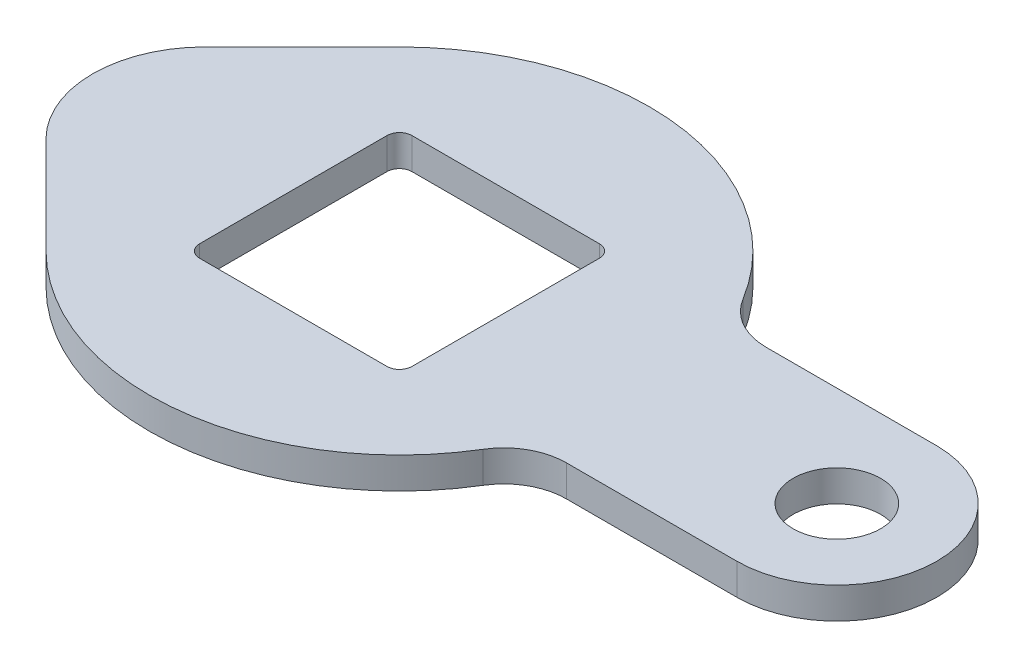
SolidWorks part; units mm, degrees
ref_plane "前基準面" through (0, 0, 0) normal (0, 0, 1) x (1, 0, 0)
ref_plane "上基準面" through (0, 0, 0) normal (0, 1, 0) x (1, 0, 0)
ref_plane "右基準面" through (0, 0, 0) normal (1, 0, 0) x (0, 0, -1)
sketch "草圖1" plane through (0, 0, 0) normal (0, 1, 0) x (1, 0, 0)
  line L0 (-52.9239, 0) -> (52.9239, 0) construction
  line L1 (0, 24.8748) -> (0, -24.8748) construction
  line L2 (-14.1421, 14.1421) -> (-21.9203, 6.364)
  line L3 (-21.9203, -6.364) -> (-14.1421, -14.1421)
  line L4 (-7.5, 8.5) -> (7.5, 8.5)
  line L5 (-8.5, 7.5) -> (-8.5, -7.5)
  line L6 (-7.5, -8.5) -> (7.5, -8.5)
  line L7 (8.5, 7.5) -> (8.5, -7.5)
  line L8 (35, 8) -> (21.3542, 8)
  line L9 (35, -8) -> (21.3542, -8)
  arc A0 (-7.5, 8.5) -> (-8.5, 7.5) centre (-7.5, 7.5) ccw
  arc A1 (-8.5, -7.5) -> (-7.5, -8.5) centre (-7.5, -7.5) ccw
  arc A2 (7.5, -8.5) -> (8.5, -7.5) centre (7.5, -7.5) ccw
  arc A3 (7.5, 8.5) -> (8.5, 7.5) centre (7.5, 7.5) cw
  circle A4 centre (35, 0) radius 3.5
  arc A5 (35, -8) -> (35, 8) centre (35, 0) ccw
  arc A6 (17.0833, 10.4) -> (-14.1421, 14.1421) centre (0, 0) ccw
  arc A7 (-21.9203, -6.364) -> (-21.9203, 6.364) centre (-15.5563, 0) cw
  arc A8 (-14.1421, -14.1421) -> (17.0833, -10.4) centre (0, 0) ccw
  arc A9 (21.3542, 8) -> (17.0833, 10.4) centre (21.3542, 13) cw
  arc A10 (17.0833, -10.4) -> (21.3542, -8) centre (21.3542, -13) cw
  point P13 (-8.5, 8.5)
  point P20 (8.5, 8.5)
  point P31 (18.3759, 7.8947)
  point P36 (-28.2843, 0)
  dimension "D3" = 1
  dimension "D4" = 7
  dimension "D1" = 35
  dimension "D5" = 16
  dimension "D6" = 20
  dimension "D7" = 9
  dimension "D9" = 5
  dimension "D2" = 17
extrude "伸長1" add sketch "草圖1" against normal blind 2.5
